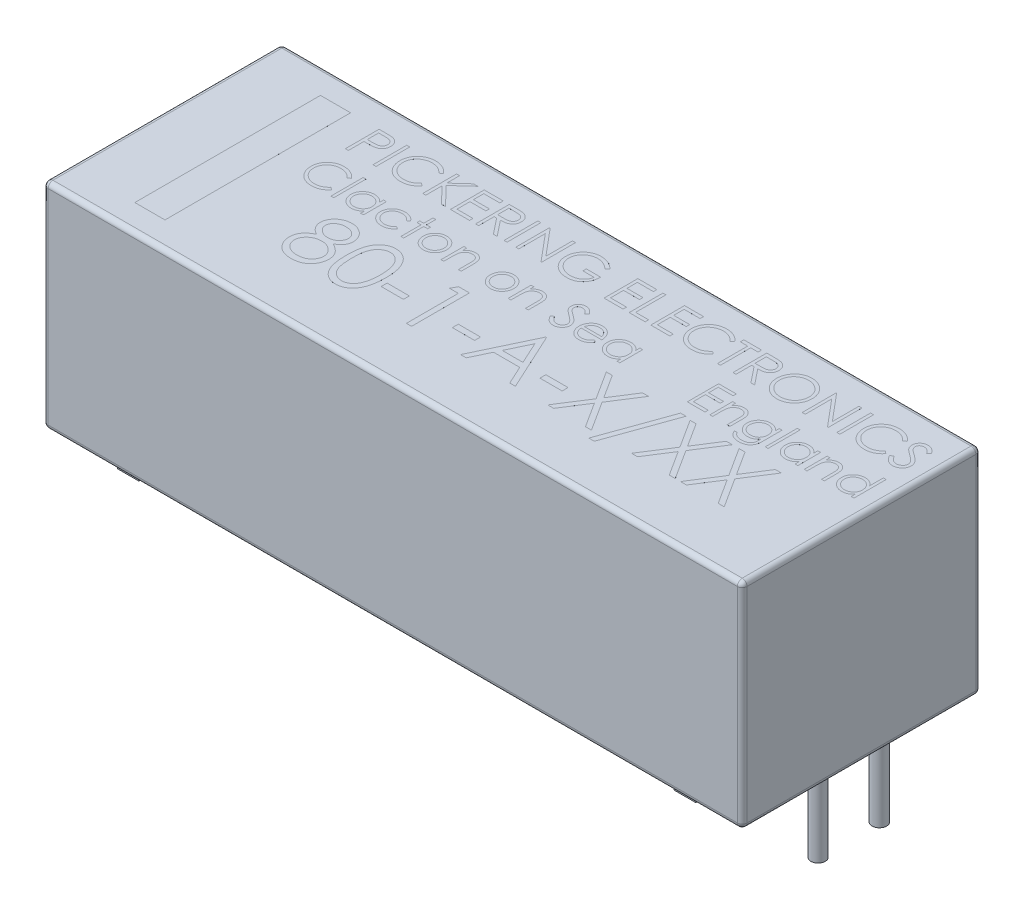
SolidWorks part; units mm, degrees
ref_plane "Front Plane" through (0, 0, 0) normal (0, 0, 1) x (1, 0, 0)
ref_plane "Top Plane" through (0, 0, 0) normal (0, 1, 0) x (1, 0, 0)
ref_plane "Right Plane" through (0, 0, 0) normal (1, 0, 0) x (0, 0, -1)
sketch "Sketch2" plane through (0, 0, 0) normal (0, 1, 0) x (1, 0, 0)
  line L1 (14.5, -4.95) -> (-14.5, -4.95)
  line L2 (14.5, -4.95) -> (14.5, 4.95)
  line L3 (14.5, 4.95) -> (-14.5, 4.95)
  line L4 (-14.5, -4.95) -> (-14.5, 4.95)
  line L5 (14.5, -4.95) -> (-14.5, 4.95) construction
  line L6 (14.5, 4.95) -> (-14.5, -4.95) construction
  point P0 (0, 0)
  dimension "D1" = 9.9
  dimension "D2" = 29
extrude "Main Body" add sketch "Sketch2" along normal blind 8.89 draft 0.023
sketch "Sketch3"
  dimension "D1" = 1.25
  dimension "D2" = 7.7
  dimension "D3" = 1.0965
  dimension "D4" = 2.7
  dimension "D5" = 1.4
  dimension "D6" = 2
extrude "Lettering" add sketch "Sketch3" along normal blind 0.0001
sketch "Sketch4" plane through (0, 0, 0) normal (0, -1, 0) x (1, 0, 0)
  line L0 (-14.5, -4.95) -> (-14.5, 4.95) construction
  line L1 (-12, 4.375) -> (-11.1, 4.375)
  line L2 (-12, 4.375) -> (-12, -4.375)
  line L3 (-12, -4.375) -> (-11.1, -4.375)
  line L4 (-11.1, 4.375) -> (-11.1, -4.375)
  line L5 (-14.5, 4.95) -> (14.5, 4.95) construction
  dimension "D1" = 8.75
  dimension "D2" = 0.9
  dimension "D3" = 2.5
  dimension "D4" = 0.575
extrude "Bobbin feet" add sketch "Sketch4" along normal blind 0.51
sketch "Sketch5" plane through (0, -0.51, 0) normal (0, -1, 0) x (1, 0, 0)
  line L0 (-11.1, -4.375) -> (-11.1, 4.375) construction
  line L1 (-11.1, -2.9375) -> (-12, -2.9375)
  line L2 (-11.1, -2.9375) -> (-11.1, -1.9375)
  line L3 (-11.1, -1.9375) -> (-12, -1.9375)
  line L4 (-12, -2.9375) -> (-12, -1.9375)
  line L5 (-12, 4.375) -> (-12, -4.375) construction
  line L6 (-12, 4.375) -> (-12, -4.375) construction
  line L7 (-12, -0.5) -> (-11.1, -0.5)
  line L8 (-12, -0.5) -> (-12, 0.5)
  line L9 (-12, 0.5) -> (-11.1, 0.5)
  line L10 (-11.1, -0.5) -> (-11.1, 0.5)
  line L11 (-11.1, 1.9375) -> (-12, 1.9375)
  line L12 (-11.1, 1.9375) -> (-11.1, 2.9375)
  line L13 (-11.1, 2.9375) -> (-12, 2.9375)
  line L14 (-12, 1.9375) -> (-12, 2.9375)
  line L15 (-12, -4.375) -> (-11.1, -4.375) construction
  dimension "D1" = 1.4375
  dimension "D2" = 1
  dimension "D3" = 1.4375
  dimension "D4" = 1
  dimension "D5" = 1
  dimension "D6" = 1.4375
extrude "Bobbin feet cut" cut sketch "Sketch5" against normal up to surface (0.51 mm away)
sketch "Sketch8" plane through (0, 0, 0) normal (0, -1, 0) x (1, 0, 0)
  line L0 (-14.5, -4.95) -> (-14.5, 4.95) construction
  line L1 (-12, -4.375) -> (-13.925, -4.375)
  line L2 (-12, -4.375) -> (-12, -2.9375)
  line L3 (-12, -2.9375) -> (-13.925, -2.9375)
  line L4 (-13.925, -4.375) -> (-13.925, -2.9375)
  line L5 (-12, -2.9375) -> (-11.1, -2.9375) construction
  dimension "D1" = 0.575
extrude "Extrude5" add sketch "Sketch8" along normal blind 0.1
pattern_linear "LPattern1" count 4 spacing 2.4385 along (0, 0, 1) of "Extrude5"
mirror "Mirror1" about plane through (0, 0, 0) normal (1, 0, 0) of "Extrude5", "Bobbin feet cut", "Bobbin feet", "LPattern1"
sketch "Sketch9" plane through (0, 0, 0) normal (0, -1, 0) x (1, 0, 0)
  line L0 (14.5, -4.95) -> (-14.5, -4.95) construction
  line L1 (14.5, 4.95) -> (14.5, -4.95) construction
  circle A0 centre (12.7, -2.54) radius 0.3
  circle A1 centre (12.7, 0) radius 0.2963
  dimension "D1" = 0.6
  dimension "D2" = 2.41
  dimension "D3" = 2.54
  dimension "D4" = 1.8
extrude "Pins" add sketch "Sketch9" along normal blind 4.31
mirror "Mirror2" about plane through (0, 0, 0) normal (1, 0, 0) of "Pins"
fillet "Fillet1" radius 0.2 12 edges at (14.4983, 4.445, -4.9483) (0, 8.89, -4.9465) (-14.4983, 4.445, -4.9483) (0, 0, -4.95) (14.5, 0, 0) (0, 0, 4.95) (-14.5, 0, 0) (-14.4983, 4.445, 4.9483) (14.4983, 4.445, 4.9483) (14.4965, 8.89, 0) (-14.4965, 8.89, 0) (0, 8.89, 4.9465)
